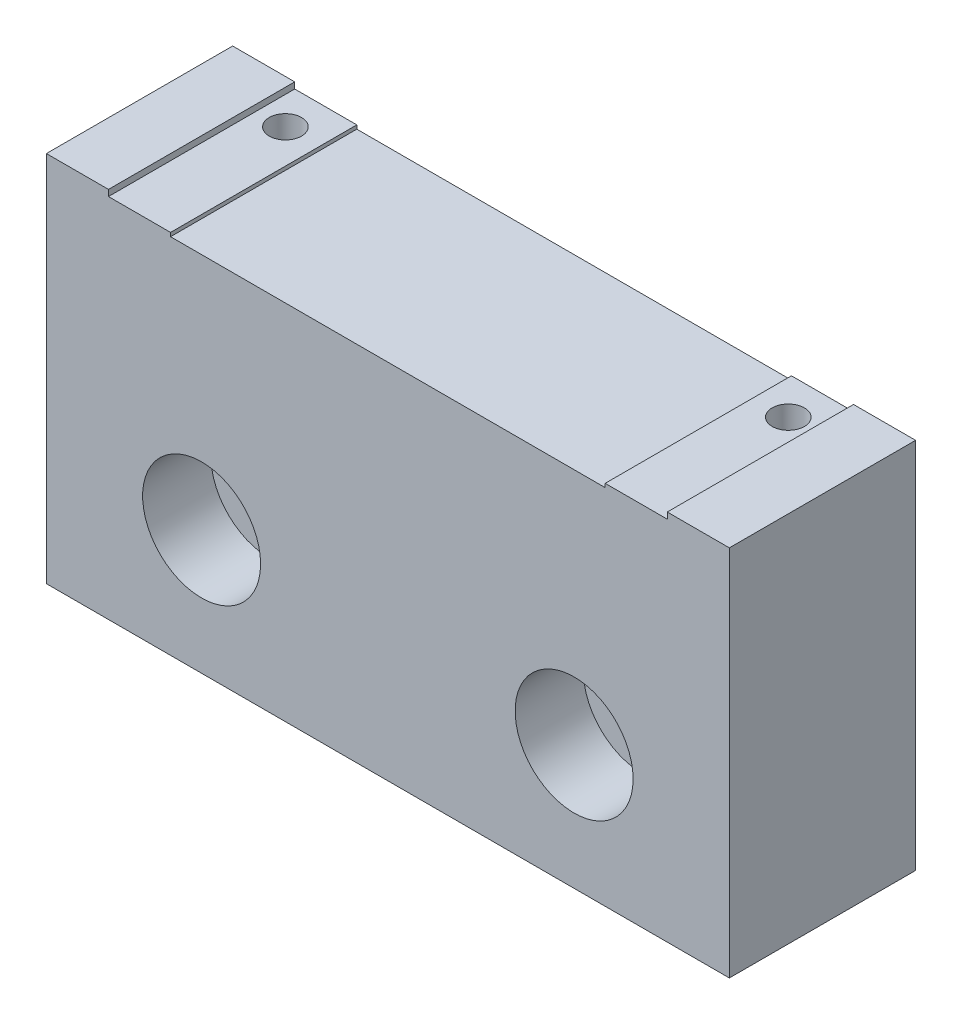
SolidWorks part; units mm, degrees
ref_plane "前视基准面" through (0, 0, 0) normal (0, 0, 1) x (1, 0, 0)
ref_plane "上视基准面" through (0, 0, 0) normal (0, 1, 0) x (1, 0, 0)
ref_plane "右视基准面" through (0, 0, 0) normal (1, 0, 0) x (0, 0, -1)
sketch "草图1" plane through (0, 0, 0) normal (0, 0, 1) x (1, 0, 0)
  line L0 (0, 0) -> (0, 30)
  line L1 (55, 0) -> (55, 30)
  line L2 (0, 30) -> (5, 30)
  line L3 (0, 0) -> (55, 0)
  line L4 (5, 29.5) -> (10, 29.5)
  line L5 (5, 29.5) -> (5, 30)
  line L6 (50, 29.5) -> (50, 30)
  line L7 (50, 30) -> (55, 30)
  line L8 (10, 29.2) -> (10, 29.5)
  line L9 (45, 29.2) -> (45, 29.5)
  line L10 (10, 29.2) -> (45, 29.2)
  line L11 (45, 29.5) -> (50, 29.5)
  circle A0 centre (12.5, 10) radius 2.75
  circle A1 centre (42.5, 10) radius 2.75
extrude "凸台-拉伸1" add sketch "草图1" along normal blind 15
sketch "草图2" plane through (0, 0, 15) normal (0, 0, 1) x (1, 0, 0)
  circle A0 centre (12.5, 10) radius 4.75
  circle A1 centre (42.5, 10) radius 4.75
extrude "切除-拉伸1" cut sketch "草图2" against normal blind 5.5
sketch "草图3" plane through (0, 30, 0) normal (0, 1, 0) x (1, 0, 0)
  circle A0 centre (47.7587, -3.012) radius 1.3
  circle A1 centre (7.2587, -3.012) radius 1.3
extrude "切除-拉伸2" cut sketch "草图3" against normal through all
